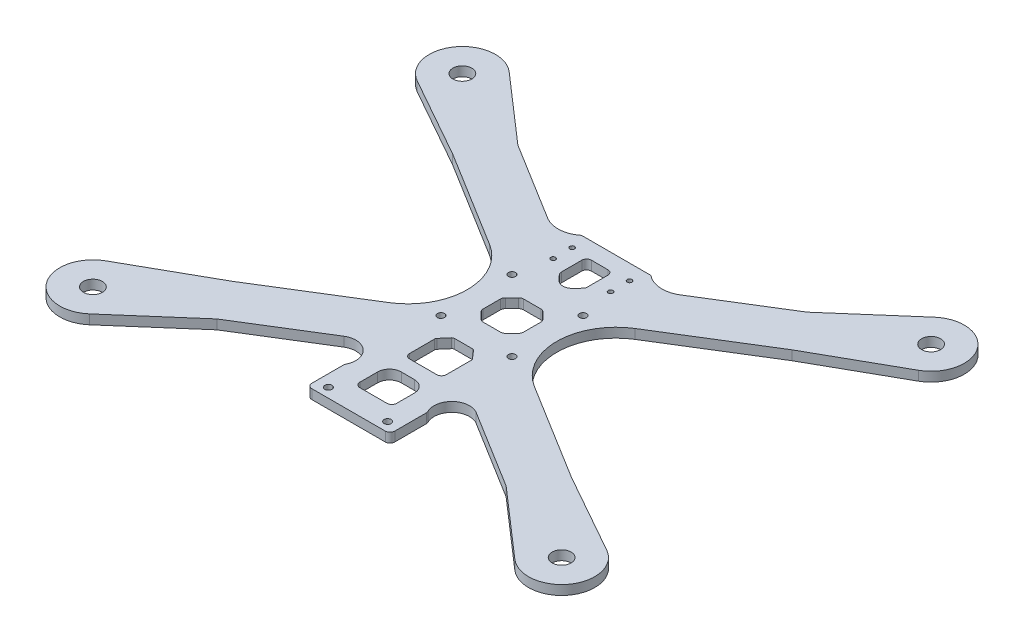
SolidWorks part; units mm, degrees
ref_plane "Front Plane" through (0, 0, 0) normal (0, 0, 1) x (1, 0, 0)
ref_plane "Top Plane" through (0, 0, 0) normal (0, 1, 0) x (1, 0, 0)
ref_plane "Right Plane" through (0, 0, 0) normal (1, 0, 0) x (0, 0, -1)
imported_body "Imported1"
sketch "Sketch1" plane through (0, 4000, 0) normal (0, 1, 0) x (1, 0, 0)
  line L0 (0, -14500) -> (0, -26500) construction
  line L2 (0, -43500) -> (0, -50000) construction
  line L3 (-86615.0296, 61599.0079) -> (0, 0) construction
  line L4 (-61065.3343, 57548.2101) -> (-27908.9813, 37030.4337) construction
  line L6 (86615.0281, -73599.011) -> (-86615.0296, 61599.0079) construction
  line L7 (-86615.0296, 61599.0079) -> (-86615.03, -73599.0091) construction
  line L8 (-86615.03, -73599.0091) -> (86615.0281, -73599.011) construction
  line L9 (0, -64500) -> (0, -75000) construction
  line L11 (-71589.6149, 40541.1644) -> (-30733.778, 15258.8053) construction
  line L12 (-61065.3343, 57548.2101) -> (-27908.9813, 37030.4337)
  line L13 (-61065.3343, 57548.2101) -> (-71589.6149, 40541.1644)
  line L14 (3500, 31000) -> (-3500, 31000)
  line L15 (-71589.6149, 40541.1644) -> (-30733.778, 15258.8053)
  line L16 (-14641.6759, 38000) -> (14641.6759, 38000) construction
  line L17 (-14641.6759, 38000) -> (14641.6759, 38000)
  line L18 (0, 38000) -> (0, 31000) construction
  line L19 (15500, -75000) -> (-15500, -75000) construction
  line L20 (-15500, -75000) -> (15500, -75000)
  line L21 (-17500, -59673.9998) -> (-17500, -73000)
  line L22 (-66327.4746, 49044.6873) -> (-147817.5839, 99472.2995) construction
  line L23 (0, 15508.707) -> (0, 2500) construction
  line L24 (-30733.778, -27258.8062) -> (-71589.6149, -52541.1644) construction
  line L25 (-61065.3343, -69548.2101) -> (-27946.6038, -49053.7148) construction
  line L26 (-71589.6149, -52541.1644) -> (-61065.3343, -69548.2101)
  line L27 (-66327.4746, -61044.6873) -> (-129615.5299, -100208.523) construction
  line L28 (-30733.778, -27258.8062) -> (-71589.6149, -52541.1644)
  line L29 (-61065.3343, -69548.2101) -> (-27946.6038, -49053.7148)
  line L30 (3500, 31000) -> (-3500, 31000) construction
  line L31 (-5500, 29000) -> (-5500, 20296.5546) construction
  line L32 (-5500, 29000) -> (-5500, 20296.5546)
  line L33 (-2904.7375, 16758.707) -> (-4952.3687, 18921.5546) construction
  line L34 (-2904.7375, 16758.707) -> (-4952.3687, 18921.5546)
  line L35 (-7914.2137, -914.2137) -> (-5085.7863, 1914.2134) construction
  line L36 (3671.5729, 2500) -> (-3671.5729, 2500) construction
  line L37 (-8500, -9671.5727) -> (-8500, -2328.4273) construction
  line L38 (-5750, -64500) -> (5750, -64500) construction
  line L39 (-7750, -55000) -> (-7750, -62500) construction
  line L40 (2750, -50000) -> (-2750, -50000) construction
  line L41 (-5750, -43500) -> (5750, -43500) construction
  line L42 (-7750, -30871.8071) -> (-7750, -41500) construction
  line L43 (-4597.5466, -26846.6969) -> (-7507.0968, -30218.5059) construction
  line L44 (3574.1944, -26500) -> (-3840.4498, -26500) construction
  line L45 (-3671.5729, -14500) -> (3671.5729, -14500) construction
  line L46 (-7914.2137, -11085.7868) -> (-5085.7863, -13914.2132) construction
  line L47 (-5750, -64500) -> (5750, -64500)
  line L48 (-7750, -55000) -> (-7750, -62500)
  line L49 (2750, -50000) -> (-2750, -50000)
  line L50 (-5750, -43500) -> (5750, -43500)
  line L51 (-7750, -30871.8071) -> (-7750, -41500)
  line L52 (-4597.5466, -26846.6969) -> (-7507.0968, -30218.5059)
  line L53 (3840.4498, -26500) -> (-3840.4498, -26500)
  line L54 (-3671.5729, -14500) -> (3671.5729, -14500)
  line L55 (-7914.2137, -11085.7868) -> (-5085.7863, -13914.2132)
  line L56 (-7914.2137, -914.2137) -> (-5085.7863, 1914.2134)
  line L57 (-8500, -9671.5727) -> (-8500, -2328.4273)
  line L58 (3671.5729, 2500) -> (-3671.5729, 2500)
  line L61 (8500, -9671.5727) -> (8500, -2328.4273)
  line L62 (7914.2137, -914.2137) -> (5085.7863, 1914.2134)
  line L63 (7914.2137, -11085.7868) -> (5085.7863, -13914.2132)
  line L64 (4597.5466, -26846.6969) -> (7507.0968, -30218.5059)
  line L65 (7750, -30871.8071) -> (7750, -41500)
  line L66 (7750, -55000) -> (7750, -62500)
  line L67 (2904.7375, 16758.707) -> (4952.3687, 18921.5546)
  line L68 (5500, 29000) -> (5500, 20296.5546)
  line L69 (61065.3343, -69548.2101) -> (27946.6038, -49053.7148)
  line L70 (30733.778, -27258.8062) -> (71589.6149, -52541.1644)
  line L71 (71589.6149, -52541.1644) -> (61065.3343, -69548.2101)
  line L72 (17500, -59673.9998) -> (17500, -73000)
  line L73 (71589.6149, 40541.1644) -> (30733.778, 15258.8053)
  line L74 (61065.3343, 57548.2101) -> (71589.6149, 40541.1644)
  line L75 (61065.3343, 57548.2101) -> (27908.9813, 37030.4337)
  circle A1 centre (-14999.9992, 9000) radius 1500.0002
  circle A3 centre (-86615.0296, 61599.0079) radius 3500.0012 construction
  circle A4 centre (-86615.03, -73599.0091) radius 3499.9981 construction
  circle A5 centre (86615.0281, -73599.011) radius 3499.9997 construction
  arc A6 (-17500, -73000) -> (-15500, -75000) centre (-15500.0017, -73000.0017) ccw
  arc A7 (-27908.9813, 37030.4337) -> (-14641.6759, 38000) centre (-21959.2778, 46874.2069) ccw
  arc A8 (-3500, 31000) -> (-5500, 29000) centre (-3500, 29000) ccw
  arc A9 (-5500, 20296.5546) -> (-4952.3687, 18921.5546) centre (-3500, 20296.5546) ccw
  arc A10 (-2904.7375, 16758.707) -> (0, 15508.707) centre (0.0003, 19508.7076) ccw
  arc A11 (-3671.5729, 2500) -> (-5085.7863, 1914.2134) centre (-3671.5729, 500.0007) ccw
  arc A12 (-7914.2137, -914.2137) -> (-8500, -2328.4273) centre (-6500.0005, -2328.4269) ccw
  arc A13 (-8500, -9671.5727) -> (-7914.2137, -11085.7868) centre (-6499.9984, -9671.5727) ccw
  arc A14 (-5085.7863, -13914.2132) -> (-3671.5729, -14500) centre (-3671.5715, -12499.9979) ccw
  arc A15 (-3840.4498, -26500) -> (-4597.5466, -26846.6969) centre (-3840.4509, -27499.9983) ccw
  arc A16 (-7507.0968, -30218.5059) -> (-7750, -30871.8071) centre (-6750.0041, -30871.8071) ccw
  arc A17 (-7750, -41500) -> (-5750, -43500) centre (-5750, -41500) ccw
  arc A18 (-2750, -50000) -> (-7750, -55000) centre (-2750, -55000) ccw
  arc A19 (-7750, -62500) -> (-5750, -64500) centre (-5750, -62500) ccw
  arc A20 (-17500, -59673.9998) -> (-17289.4745, -58780.8113) centre (-15500.0108, -59673.9947) cw
  arc A21 (-27946.6038, -49053.7148) -> (-17289.4745, -58780.8113) centre (-23999.9992, -55431.3558) cw
  arc A22 (-30733.778, 15258.8053) -> (-30733.778, -27258.8062) centre (-43889.1257, -6000.0005) cw
  circle A23 centre (-15000, -20999.9997) radius 1499.9996
  circle A24 centre (-12499.9971, -71000.001) radius 1500.0009
  circle A25 centre (-12125, 31500.0001) radius 1000.0003
  circle A26 centre (-12124.9997, 23499.9999) radius 1000.0002
  circle A27 centre (12124.9997, 23499.9999) radius 1000.0002
  circle A28 centre (12125, 31500.0001) radius 1000.0003
  circle A29 centre (12499.9971, -71000.001) radius 1500.0009
  circle A30 centre (15000, -20999.9997) radius 1499.9996
  arc A31 (30733.778, 15258.8053) -> (30733.778, -27258.8062) centre (43889.1257, -6000.0005) ccw
  arc A32 (27946.6038, -49053.7148) -> (17289.4745, -58780.8113) centre (23999.9992, -55431.3558) ccw
  arc A33 (17500, -59673.9998) -> (17289.4745, -58780.8113) centre (15500.0108, -59673.9947) ccw
  arc A34 (7750, -62500) -> (5750, -64500) centre (5750, -62500) cw
  arc A35 (2750, -50000) -> (7750, -55000) centre (2750, -55000) cw
  arc A36 (7750, -41500) -> (5750, -43500) centre (5750, -41500) cw
  arc A37 (7507.0968, -30218.5059) -> (7750, -30871.8071) centre (6750.0041, -30871.8071) cw
  arc A38 (3840.4498, -26500) -> (4597.5466, -26846.6969) centre (3840.4509, -27499.9983) cw
  arc A39 (5085.7863, -13914.2132) -> (3671.5729, -14500) centre (3671.5715, -12499.9979) cw
  arc A40 (8500, -9671.5727) -> (7914.2137, -11085.7868) centre (6499.9984, -9671.5727) cw
  arc A41 (7914.2137, -914.2137) -> (8500, -2328.4273) centre (6500.0005, -2328.4269) cw
  arc A42 (3671.5729, 2500) -> (5085.7863, 1914.2134) centre (3671.5729, 500.0007) cw
  arc A43 (2904.7375, 16758.707) -> (0, 15508.707) centre (-0.0003, 19508.7076) cw
  arc A44 (5500, 20296.5546) -> (4952.3687, 18921.5546) centre (3500, 20296.5546) cw
  arc A45 (3500, 31000) -> (5500, 29000) centre (3500, 29000) cw
  arc A46 (27908.9813, 37030.4337) -> (14641.6759, 38000) centre (21959.2778, 46874.2069) cw
  arc A47 (17500, -73000) -> (15500, -75000) centre (15500.0017, -73000.0017) cw
  circle A48 centre (14999.9992, 9000) radius 1500.0002
extrude "Boss-Extrude2" add sketch "Sketch1" along normal mid plane 4000 separate body
sketch "Sketch3" plane through (0, 0, 0) normal (0, 1, 0) x (1, 0, 0)
  circle A0 centre (0, 0) radius 151631.5625
extrude "Cut-Extrude1" cut sketch "Sketch3" along normal through all
scale "Scale1" bodies to scale 104 scale about centroid uniform scaling yes scale factor 0.001
sketch "Sketch2" plane through (0, 4002, 0) normal (0, 1, 0) x (1, 0, 0)
  line L0 (-8.5, -10515.8361) -> (8.5, -10515.8361) construction
  line L1 (-8.5, -10512.1645) -> (-8.5, -10519.5077) construction
  line L2 (8.5, -10519.5077) -> (8.5, -10512.1645) construction
  line L4 (-98.9545, -10437.8361) -> (98.9545, -10593.8361) construction
  line L7 (-61.0653, -10452.2879) -> (-89.756, -10427.2821)
  line L8 (-105.8191, -10450.0377) -> (-71.5896, -10469.2949)
  line L9 (-61.0653, -10452.2879) -> (-71.5896, -10469.2949)
  line L10 (71.5896, -10562.3773) -> (61.0653, -10579.3843)
  line L11 (61.0653, -10579.3843) -> (89.756, -10604.3901)
  line L12 (71.5896, -10562.3773) -> (105.8191, -10581.6345)
  line L13 (0, -10402.9436) -> (0, -10696.7702) construction
  line L14 (-61.0653, -10579.3843) -> (-89.756, -10604.3901)
  line L15 (-71.5896, -10562.3773) -> (-105.8191, -10581.6345)
  line L16 (-71.5896, -10562.3773) -> (-61.0653, -10579.3843)
  line L17 (61.0653, -10452.2879) -> (71.5896, -10469.2949)
  line L18 (61.0653, -10452.2879) -> (89.756, -10427.2821)
  line L19 (105.8191, -10450.0377) -> (71.5896, -10469.2949)
  line L20 (-98.9545, -10593.8361) -> (98.9545, -10437.8361) construction
  circle A0 centre (-98.9545, -10437.8361) radius 4
  circle A1 centre (98.9545, -10593.8361) radius 4
  arc A2 (-89.756, -10427.2821) -> (-105.8191, -10450.0377) centre (-98.9545, -10437.8361) ccw
  arc A4 (89.756, -10604.3901) -> (105.8191, -10581.6345) centre (98.9545, -10593.8361) ccw
  circle A5 centre (-98.9545, -10593.8361) radius 4
  arc A6 (-89.756, -10604.3901) -> (-105.8191, -10581.6345) centre (-98.9545, -10593.8361) cw
  circle A7 centre (98.9545, -10437.8361) radius 4
  arc A8 (89.756, -10427.2821) -> (105.8191, -10450.0377) centre (98.9545, -10437.8361) cw
  point P15 (0, -10515.8361)
  dimension "D2" = 8
  dimension "D3" = 28
  dimension "D1" = 252
  dimension "D4" = 156
extrude "Boss-Extrude3" add sketch "Sketch2" against normal up to surface (4 mm away)
ref_point "Point1"
ref_plane "Plane1" through (0, 0, 10515.8361) normal (0, 0, 1) x (1, 0, 0)
ref_plane "Plane2" through (0, 0, 0) normal (1, 0, 0) x (0, 0, -1)
ref_plane "Plane3" through (0, 4000, 0) normal (0, 1, 0) x (1, 0, 0)
sketch "Sketch4" plane through (0, 4002, 0) normal (0, 1, 0) x (1, 0, 0)
  circle A0 centre (-98.9545, -10593.8361) radius 76
  circle A1 centre (98.9545, -10593.8361) radius 76
  circle A2 centre (98.9545, -10437.8361) radius 76
  circle A3 centre (-98.9545, -10437.8361) radius 76
  dimension "D1" = 152
sketch "Sketch5" plane through (0, 4002, 0) normal (0, 1, 0) x (1, 0, 0)
  line L0 (0, -10515.8361) -> (172.554, -10515.8361) construction
  line L1 (-42.4123, -10515.8361) -> (42.4123, -10515.8361) construction
